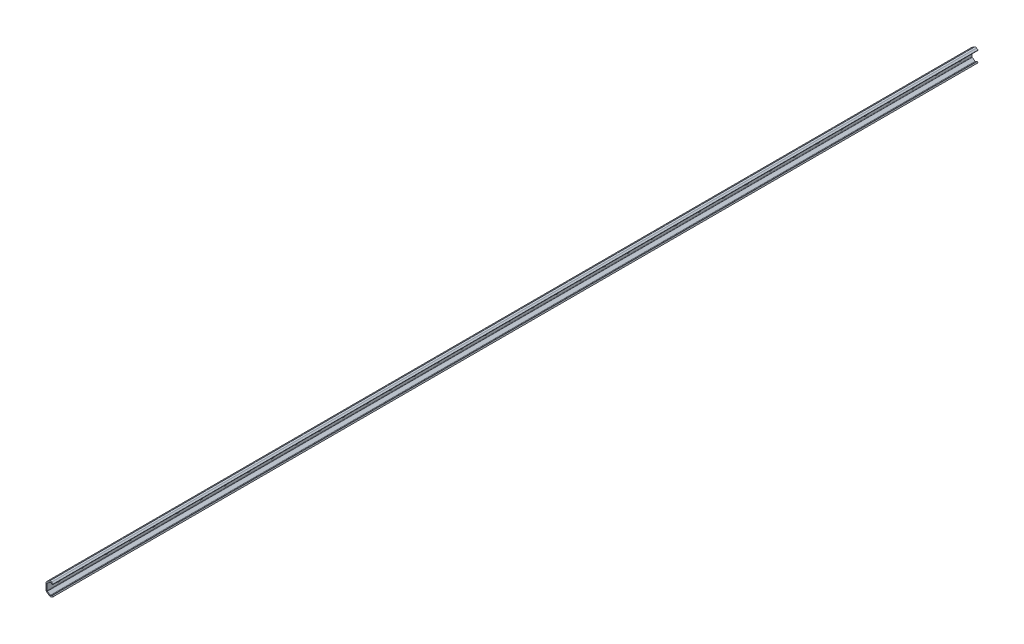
SolidWorks part; units mm, degrees
ref_plane "Front Plane" through (0, 0, 0) normal (0, 0, 1) x (1, 0, 0)
ref_plane "Top Plane" through (0, 0, 0) normal (0, 1, 0) x (1, 0, 0)
ref_plane "Right Plane" through (0, 0, 0) normal (1, 0, 0) x (0, 0, -1)
sketch "Sketch1" plane through (0, 0, 0) normal (0, 0, 1) x (1, 0, 0)
  line L0 (21.7057, -15.4016) -> (24, -18.6782)
  line L1 (24, -18.6782) -> (19.0362, -22.1539)
  line L2 (11.9638, -22.1539) -> (3.3719, -16.1378)
  line L3 (0, -10.44) -> (0, 10.44)
  line L4 (3.3719, 16.1378) -> (11.9638, 22.1539)
  line L5 (19.0362, 22.1539) -> (24, 18.6782)
  line L6 (24, 18.6782) -> (21.7057, 15.4016)
  line L7 (21.7057, 15.4016) -> (16.814, 18.8268)
  line L8 (14.186, 18.8268) -> (4.7304, 12.206)
  line L9 (4.7304, -12.206) -> (14.186, -18.8268)
  line L10 (4, 10.44) -> (4, -10.44)
  line L11 (16.814, -18.8268) -> (21.7057, -15.4016)
  arc A0 (19.0362, -22.1539) -> (11.9638, -22.1539) centre (15.5, -17.1036) cw
  arc A1 (0, -10.44) -> (3.3719, -16.1378) centre (6.5, -10.44) ccw
  arc A2 (0, 10.44) -> (3.3719, 16.1378) centre (6.5, 10.44) cw
  arc A3 (11.9638, 22.1539) -> (19.0362, 22.1539) centre (15.5, 17.1036) cw
  arc A4 (16.814, 18.8268) -> (14.186, 18.8268) centre (15.5, 16.9503) ccw
  arc A5 (4.7304, 12.206) -> (4, 10.44) centre (5.7497, 10.7503) ccw
  arc A6 (4, -10.44) -> (4.7304, -12.206) centre (6.5, -10.44) ccw
  arc A7 (14.186, -18.8268) -> (16.814, -18.8268) centre (15.5, -16.9503) ccw
  dimension "D1" = 6.1652
  dimension "D2" = 6.5
  dimension "D3" = 6.5
  dimension "D4" = 6.1652
  dimension "D5" = 2.2909
  dimension "D6" = 1.777
  dimension "D7" = 2.5
  dimension "D8" = 2.2909
  dimension "D9" = 3.3719
  dimension "D10" = 3.3719
  dimension "D11" = 4
  dimension "D12" = 4.7304
  dimension "D13" = 4.7304
  dimension "D14" = 5.7497
  dimension "D15" = 6.5
  dimension "D16" = 11.9638
  dimension "D17" = 14.186
  dimension "D18" = 15.5
  dimension "D19" = 11.9638
  dimension "D20" = 15.5
  dimension "D21" = 14.186
  dimension "D22" = 16.814
  dimension "D23" = 10.44
  dimension "D24" = 10.44
  dimension "D25" = 16.814
  dimension "D29" = 21.7057
  dimension "D30" = 21.7057
  dimension "D31" = 24
  dimension "D32" = 24
extrude "Extrude1" add sketch "Sketch1" against normal blind 3120
sketch "Sketch2" plane through (4, 0, 0) normal (1, 0, 0) x (0, 0, -1)
  line L0 (39, 0) -> (41, 0) construction
  line L1 (39, 4.5) -> (41, 4.5)
  line L2 (39, -4.5) -> (41, -4.5)
  arc A0 (39, 4.5) -> (39, -4.5) centre (39, 0) ccw
  arc A1 (41, 4.5) -> (41, -4.5) centre (41, 0) cw
  point P7 (40, 0)
  dimension "D1" = 2
  dimension "D2" = 9
  dimension "D3" = 40
extrude "Extrude2" cut sketch "Sketch2" against normal through all
pattern_linear "LPattern1" count 39 spacing 80 along (0, 0, -1) of "Extrude2"
